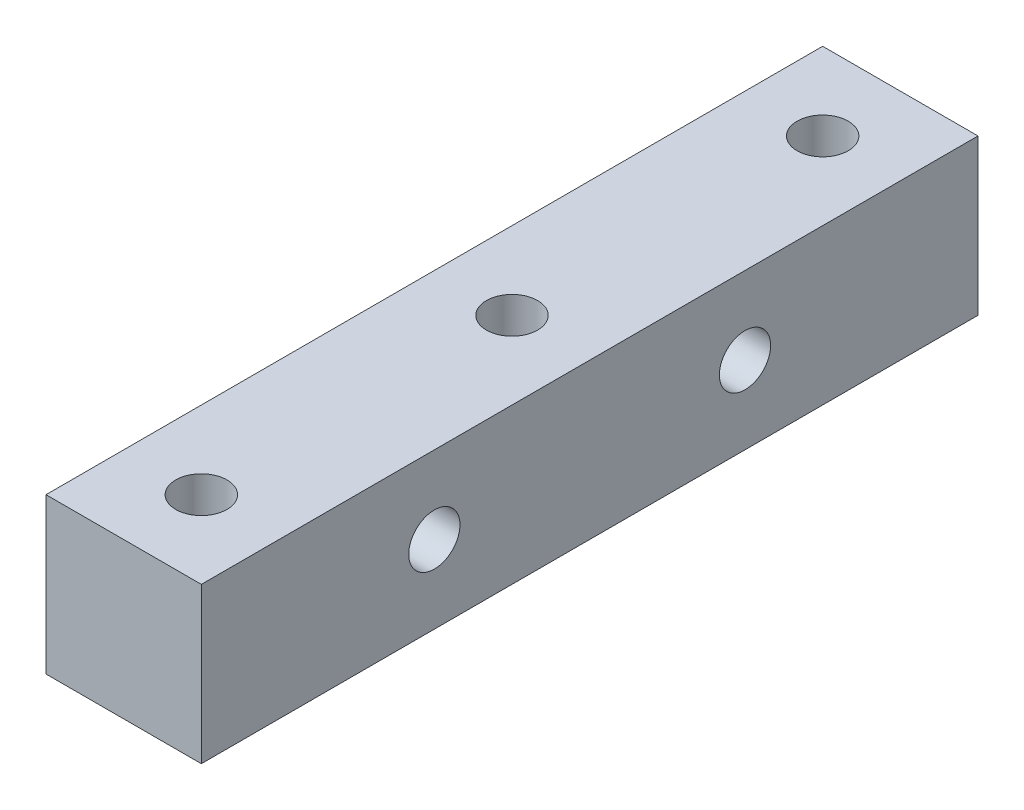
SolidWorks part; units mm, degrees
ref_plane "前视基准面" through (0, 0, 0) normal (0, 0, 1) x (1, 0, 0)
ref_plane "上视基准面" through (0, 0, 0) normal (0, 1, 0) x (1, 0, 0)
ref_plane "右视基准面" through (0, 0, 0) normal (1, 0, 0) x (0, 0, -1)
other "Configuration Table"
sketch "草图1" plane through (0, 0, 0) normal (0, 0, 1) x (1, 0, 0)
  line L1 (-5, 5) -> (5, 5)
  line L2 (-5, 5) -> (-5, -5)
  line L3 (-5, -5) -> (5, -5)
  line L4 (5, 5) -> (5, -5)
  line L5 (-5, 5) -> (5, -5) construction
  line L6 (-5, -5) -> (5, 5) construction
  point P0 (0, 0)
  dimension "D1" = 10
  dimension "D2" = 10
extrude "凸台-拉伸1" add sketch "草图1" along normal blind 50
hole_wizard "M4 螺纹孔1" positions "草图2" profile "草图3" tap size "M4" standard "GB"
sketch "草图2" plane through (0, 5, 0) normal (0, 1, 0) x (1, 0, 0)
  line L0 (5, -50) -> (-5, -50) construction
  line L1 (5, 0) -> (-5, 0) construction
  point P0 (0, -5)
  point P2 (0, -25)
  point P4 (0, -45)
  dimension "D1" = 5
  dimension "D2" = 5
  dimension "D3" = 20
sketch "草图3" plane through (0, 5, 5) normal (1, 0, 0) x (0, 0, 1)
  line L0 (0, 0) -> (0, 10)
  line L1 (0, 10) -> (1.65, 10)
  line L2 (1.65, 10) -> (1.65, 0)
  line L5 (1.65, 0) -> (0, 0)
  line L11 (0, -6.35) -> (0, 107.95) construction
  dimension "通孔螺纹孔钻头直径" = 3.3
  dimension "通孔螺纹孔钻头深度" = 10
hole_wizard "M4 螺纹孔2" positions "草图4" profile "草图5" tap size "M4" standard "GB"
sketch "草图4" plane through (5, 0, 0) normal (1, 0, 0) x (0, 0, -1)
  line L0 (0, -5) -> (0, 5) construction
  line L1 (-50, -5) -> (-50, 5) construction
  point P0 (-35, 0)
  point P2 (-15, 0)
  dimension "D1" = 15
  dimension "D2" = 15
sketch "草图5" plane through (5, 0, 35) normal (0, 1, 0) x (0, 0, -1)
  line L0 (0, 0) -> (0, 10)
  line L1 (0, 10) -> (1.65, 10)
  line L2 (1.65, 10) -> (1.65, 0)
  line L5 (1.65, 0) -> (0, 0)
  line L11 (0, -6.35) -> (0, 107.95) construction
  dimension "通孔螺纹孔钻头直径" = 3.3
  dimension "通孔螺纹孔钻头深度" = 10
